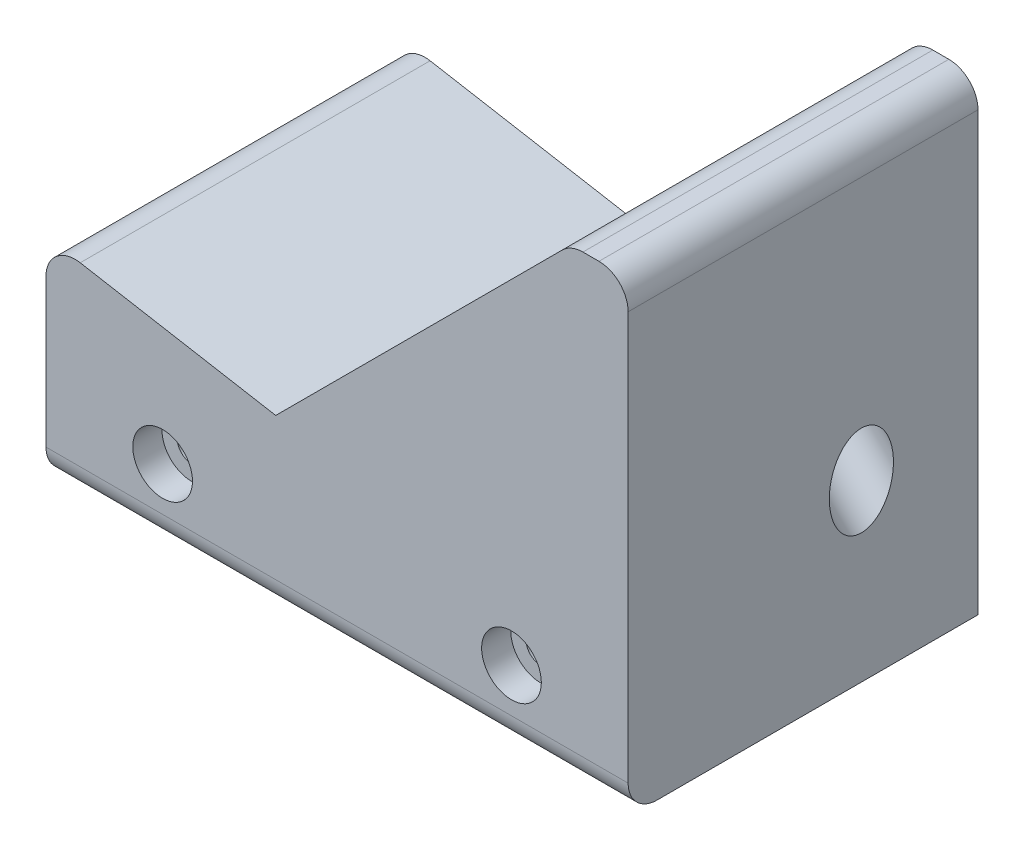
SolidWorks part; units mm, degrees
ref_plane "Front Plane" through (0, 0, 0) normal (0, 0, 1) x (1, 0, 0)
ref_plane "Top Plane" through (0, 0, 0) normal (0, 1, 0) x (1, 0, 0)
ref_plane "Right Plane" through (0, 0, 0) normal (1, 0, 0) x (0, 0, -1)
sketch "Sketch1" plane through (0, 0, 0) normal (0, 0, 1) x (1, 0, 0)
  line L0 (-63.5, 1155.7) -> (-63.5, 1201.8496)
  line L1 (63.2744, 1155.7) -> (-63.5, 1155.7)
  line L2 (63.2744, 1155.7) -> (63.2744, 1257.3)
  line L3 (63.2744, 1257.3) -> (-63.5, 1257.3) construction
  line L4 (-63.5, 1155.7) -> (-63.5, 1257.3) construction
  line L5 (63.2744, 1155.7) -> (-63.5, 1257.3) construction
  line L6 (63.2744, 1257.3) -> (-63.5, 1155.7) construction
  line L7 (-63.5, 1201.8496) -> (-13.4718, 1193.0282)
  line L8 (-13.4718, 1193.0282) -> (50.8, 1257.3)
  line L9 (50.8, 1498.6) -> (50.8, 2346.5841) construction
  line L10 (50.8, 1257.3) -> (63.2744, 1257.3)
  line L11 (71.5063, 1162.6168) -> (65.5194, 1156.6299) construction
  line L12 (68.5128, 1159.6234) -> (-21.2897, 1249.4259) construction
  point P4 (-0.1128, 1206.5)
  dimension "D1" = 101.6
  dimension "D2" = 125
  dimension "D3" = 50.8
  dimension "D4" = 127
extrude "Boss-Extrude1" add sketch "Sketch1" against normal blind 76.2 and the other way blind 12.7 contours L7 L8 L10 L2 L1 L0
fillet "Fillet1" radius 6.35 4 edges at (-0.1128, 1155.7, 12.7) (50.8, 1257.3, -31.75) (-63.5, 1201.8496, -31.75) (63.2744, 1257.3, -31.75)
sketch "Sketch2" plane through (-603.25, 603.25, 0) normal (-0.7071, 0.7071, 0) x (0, 0, 1)
  line L0 (12.7, 834.0724) -> (-76.2, 834.0724) construction
  line L1 (12.7, 834.0724) -> (12.7, 922.3361) construction
  circle A0 centre (-38.1, 888.8399) radius 6.985
  dimension "D1" = 13.97
  dimension "D2" = 54.7675
  dimension "D3" = 50.8
extrude "Cut-Extrude1" cut sketch "Sketch2" against normal through all
sketch "Sketch4" plane through (0, 0, -76.2) normal (0, 0, -1) x (-1, 0, 0)
  line L6 (-53.4303, 1257.3) -> (-56.9244, 1257.3)
  line L7 (-63.2744, 1250.95) -> (-63.2744, 1155.7)
  line L8 (-63.2744, 1155.7) -> (63.5, 1155.7)
  line L9 (63.5, 1155.7) -> (63.5, 1194.2819)
  line L10 (56.0473, 1200.5355) -> (13.4718, 1193.0282)
  line L11 (13.4718, 1193.0282) -> (-48.9401, 1255.4401)
  line L12 (-53.4303, 1257.3) -> (-56.9244, 1257.3)
  line L13 (-63.2744, 1250.95) -> (-63.2744, 1155.7)
  line L14 (-63.2744, 1155.7) -> (63.5, 1155.7)
  line L15 (63.5, 1155.7) -> (63.5, 1194.2819)
  line L16 (56.0473, 1200.5355) -> (13.4718, 1193.0282)
  line L17 (13.4718, 1193.0282) -> (-48.9401, 1255.4401)
  arc A3 (-56.9244, 1257.3) -> (-63.2744, 1250.95) centre (-56.9244, 1250.95) ccw
  arc A4 (63.5, 1194.2819) -> (56.0473, 1200.5355) centre (57.15, 1194.2819) ccw
  arc A5 (-48.9401, 1255.4401) -> (-53.4303, 1257.3) centre (-53.4303, 1250.95) ccw
  arc A6 (-56.9244, 1257.3) -> (-63.2744, 1250.95) centre (-56.9244, 1250.95) ccw
  arc A7 (63.5, 1194.2819) -> (56.0473, 1200.5355) centre (57.15, 1194.2819) ccw
  arc A8 (-48.9401, 1255.4401) -> (-53.4303, 1257.3) centre (-53.4303, 1250.95) ccw
  dimension "D1" = 0
extrude "Cut-Extrude3" cut sketch "Sketch4" against normal blind 12.7
sketch "Sketch5" plane through (0, 0, 12.7) normal (0, 0, 1) x (1, 0, 0)
  line L0 (-63.5, 1171.575) -> (63.2744, 1171.575) construction
  line L1 (-63.5, 1162.05) -> (-63.5, 1194.2819) construction
  line L2 (63.2744, 1162.05) -> (63.2744, 1250.95) construction
  line L4 (-13.4718, 1193.0282) -> (-63.5, 1193.0282) construction
  line L5 (63.2744, 1155.7) -> (-63.5, 1155.7) construction
  circle A0 centre (-38.1, 1171.575) radius 3.175
  circle A1 centre (37.8744, 1171.575) radius 3.175
  circle A2 centre (-38.1, 1171.575) radius 6.4999 construction
  circle A3 centre (37.8744, 1171.575) radius 6.4999 construction
  dimension "D2" = 6.35
  dimension "D5" = 12.9997
  dimension "D1" = 15.875
  dimension "D3" = 25.4
  dimension "D4" = 25.4
extrude "Cut-Extrude4" cut sketch "Sketch5" against normal through all
sketch "Sketch6" plane through (0, 0, 12.7) normal (0, 0, 1) x (1, 0, 0)
  circle A0 centre (37.8744, 1171.575) radius 6.4999 construction
  circle A1 centre (-38.1, 1171.575) radius 6.4999 construction
  circle A2 centre (37.8744, 1171.575) radius 6.4999
  circle A3 centre (-38.1, 1171.575) radius 6.4999
extrude "Cut-Extrude5" cut sketch "Sketch6" against normal blind 6.35
